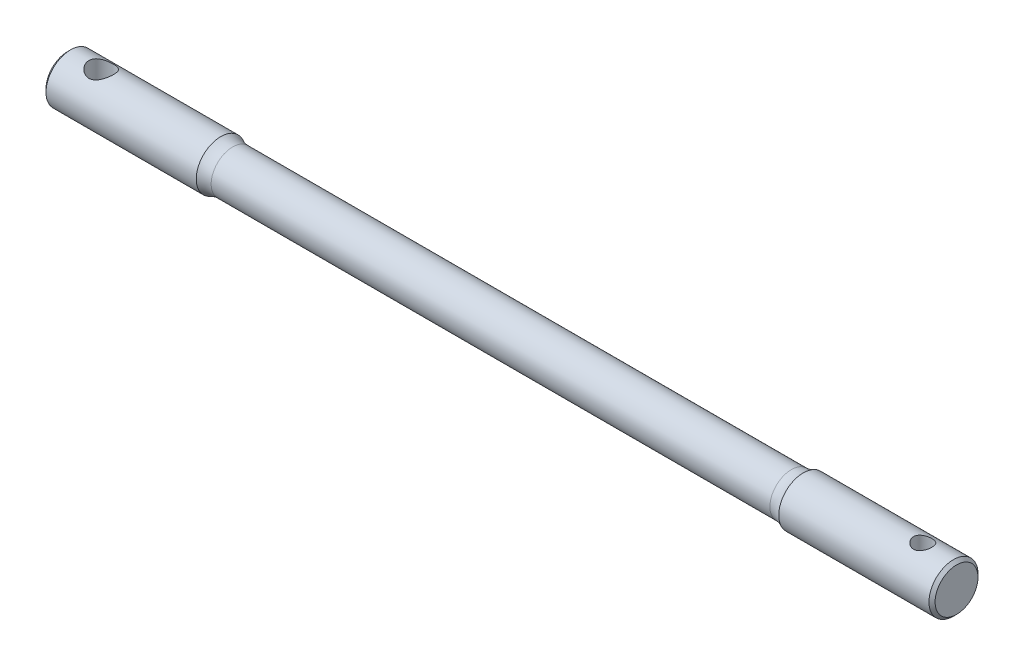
SolidWorks part; units mm, degrees
ref_plane "Plane1" through (0, 0, 0) normal (0, 0, 1) x (1, 0, 0)
ref_plane "Plane2" through (0, 0, 0) normal (0, 1, 0) x (1, 0, 0)
ref_plane "Plane3" through (0, 0, 0) normal (1, 0, 0) x (0, 0, -1)
sketch "Esquisse1" plane through (0, 0, 0) normal (0, 0, 1) x (1, 0, 0)
  line L0 (0, 0) -> (0, 4)
  line L1 (0, 4) -> (-25, 4)
  line L2 (0, 0) -> (-145, 0)
  line L3 (-26.9365, 3.5) -> (-118.0635, 3.5)
  line L5 (-120, 4) -> (-145, 4)
  line L6 (-145, 4) -> (-145, 0)
  line L7 (36, 0) -> (-132, 0) construction
  arc A0 (-120, 4) -> (-118.0635, 3.5) centre (-118.0635, 7.5) ccw
  arc A1 (-26.9365, 3.5) -> (-25, 4) centre (-26.9365, 7.5) ccw
  dimension "D7" = 8
  dimension "D2" = 8
  dimension "D1" = 25
  dimension "D3" = 145
  dimension "D4" = 4
  dimension "D5" = 3.5
  dimension "D6" = 4
revolve "Base-Révolution" add sketch "Esquisse1" angle 360 about L7
ref_plane "Plan4" through (0, 10, 0) normal (0, 1, 0) x (-1, 0, 0)
sketch "Esquisse3" plane through (0, 10, 0) normal (0, 1, 0) x (-1, 0, 0)
  line L1 (145, -4) -> (145, 4) construction
  circle A0 centre (5.5, 0) radius 1.5
  circle A1 centre (139.5, 0) radius 2
  dimension "D1" = 3
  dimension "D2" = 5.5
  dimension "D3" = 4
  dimension "D4" = 5.5
extrude "Enlèv. mat.-Extru.2" cut sketch "Esquisse3" against normal through all
chamfer "Chanfrein1" distance 0.5 angle 45
